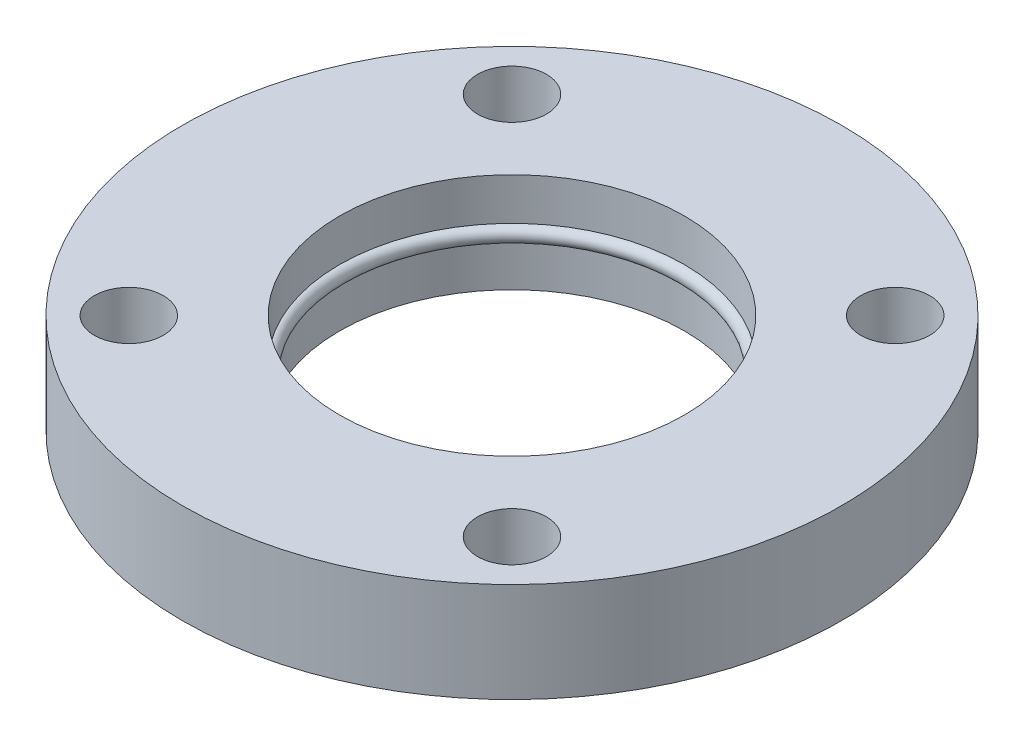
SolidWorks part; units mm, degrees
ref_plane "Front Plane" through (0, 0, 0) normal (0, 0, 1) x (1, 0, 0)
ref_plane "Top Plane" through (0, 0, 0) normal (0, 1, 0) x (1, 0, 0)
ref_plane "Right Plane" through (0, 0, 0) normal (1, 0, 0) x (0, 0, -1)
sketch "Sketch2" plane through (0, 0, 0) normal (0, 1, 0) x (1, 0, 0)
  line L1 (-25, -25) -> (25, -25) construction
  line L2 (-25, -25) -> (-25, 25) construction
  line L3 (-25, 25) -> (25, 25) construction
  line L4 (25, -25) -> (25, 25) construction
  line L5 (-25, -25) -> (25, 25) construction
  line L6 (-25, 25) -> (25, -25) construction
  circle A0 centre (0, 0) radius 22.5
  circle A1 centre (0, 0) radius 43
  circle A2 centre (-25, 25) radius 4.5
  circle A3 centre (25, 25) radius 4.5
  circle A4 centre (25, -25) radius 4.5
  circle A5 centre (-25, -25) radius 4.5
  dimension "D1" = 86
  dimension "D2" = 45
  dimension "D4" = 9
  dimension "D3" = 50
extrude "Boss-Extrude1" add sketch "Sketch2" along normal mid plane 13
sketch "Sketch3" plane through (0, 0, 0) normal (0, 0, 1) x (1, 0, 0)
  line L0 (-22.5, 0) -> (0, 0) construction
  line L1 (0, 0) -> (0, 6.5) construction
  line L2 (43, 6.5) -> (-43, 6.5) construction
  circle A0 centre (-22.5, 0) radius 1
  dimension "D1" = 2
  dimension "D2" = 45
revolve "Revolve2" add sketch "Sketch3" angle 360 about L1
